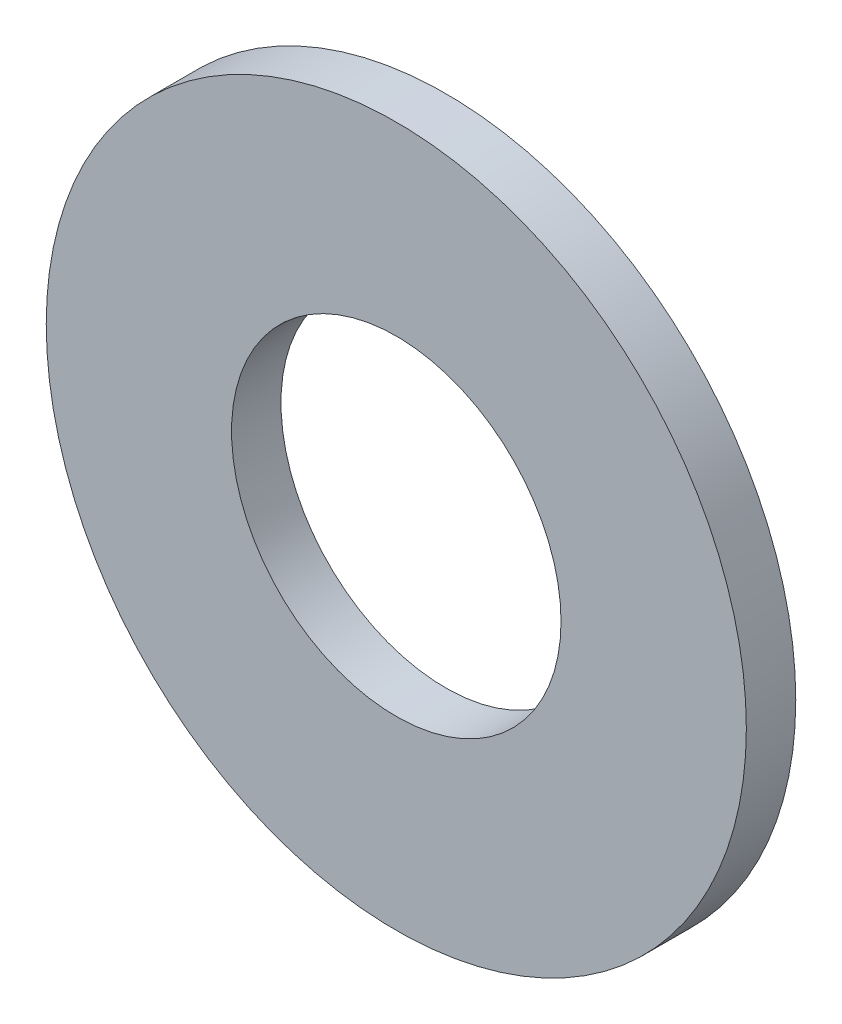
SolidWorks part; units mm, degrees
ref_plane "Front Plane" through (0, 0, 0) normal (0, 0, 1) x (1, 0, 0)
ref_plane "Top Plane" through (0, 0, 0) normal (0, 1, 0) x (1, 0, 0)
ref_plane "Right Plane" through (0, 0, 0) normal (1, 0, 0) x (0, 0, -1)
sketch "Sketch1" plane through (0, 0, 0) normal (0, 0, 1) x (1, 0, 0)
  circle A0 centre (0, 0) radius 8.5
  circle A1 centre (0, 0) radius 4
  dimension "D1" = 8
  dimension "D2" = 17
extrude "Boss-Extrude1" add sketch "Sketch1" along normal blind 1.2
